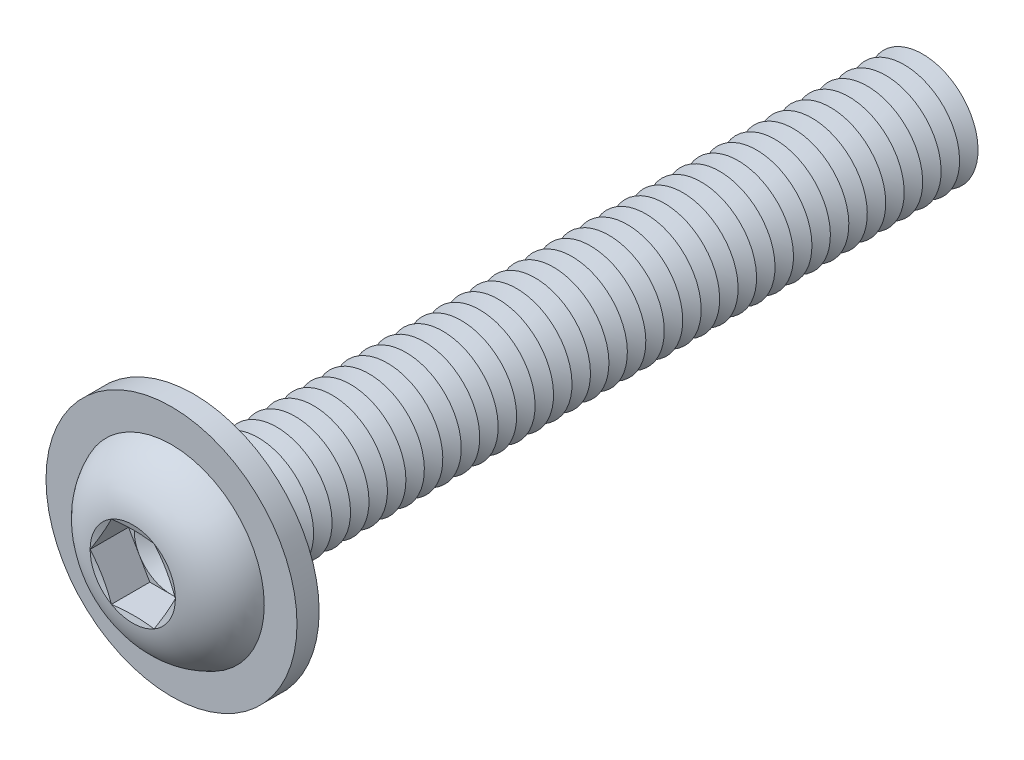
SolidWorks part; units mm, degrees
ref_plane "Front Plane" through (0, 0, 0) normal (0, 0, 1) x (1, 0, 0)
ref_plane "Top Plane" through (0, 0, 0) normal (0, 1, 0) x (1, 0, 0)
ref_plane "Right Plane" through (0, 0, 0) normal (1, 0, 0) x (0, 0, -1)
sketch "Sketch1" plane through (0, 0, 0) normal (1, 0, 0) x (0, 0, -1)
  line L0 (0, 3) -> (0, 5.25)
  line L3 (0, 3) -> (40, 3)
  line L4 (40, 3) -> (40, 0)
  line L5 (40, 0) -> (-3.3, 0) construction
  line L6 (-3.3, 0) -> (40, 0)
  line L7 (-3.3, 2.3094) -> (-3.3, 1.1547) construction
  line L8 (-3.3, 1.1547) -> (-3.3, 0)
  line L9 (-3.3, 2.3094) -> (-2.9906, 1.1547)
  line L10 (-2.9906, 1.1547) -> (-3.3, 1.1547)
  line L11 (40, 0) -> (22.7481, 0) construction
  line L12 (0, 5.25) -> (-3.3, 5.25) construction
  arc A1 (0, 5.25) -> (-3.3, 2.3094) centre (0, 1.928) ccw
  point P8 (40, 1.5)
  dimension "D1" = 10.5
  dimension "D2" = 6
  dimension "D3" = 3.3
  dimension "D4" = 4.6188
  dimension "D5" = 40
  dimension "D6" = 15
revolve "Revolve1" add sketch "Sketch1" angle 360 about L5
fillet "Fillet1" radius 0.5 1 edges at (0, 3, 0)
sketch "Sketch2" plane through (0, 0, 0) normal (1, 0, 0) x (0, 0, -1)
  line L0 (39.5, 3) -> (40.5, 3)
  line L1 (40, 3) -> (0.5, 3) construction
  line L2 (40.5, 3) -> (40, 2.134)
  line L3 (40, -3) -> (40, 3) construction
  line L4 (40, 2.134) -> (39.5, 3)
  dimension "D1" = 1
revolve "Cut-Revolve1" cut sketch "Sketch2" angle 360 about axis through (0, 0, -40) along (0, 0, -1)
pattern_linear "LPattern1" count 40 spacing 1 along (0, 0, 1) of "Cut-Revolve1"
sketch "Sketch3" plane through (0, 0, 3.3) normal (0, 0, 1) x (1, 0, 0)
  line L7 (1.1547, 2) -> (-1.1547, 2)
  line L8 (-1.1547, 2) -> (-2.3094, 0)
  line L9 (-2.3094, 0) -> (-1.1547, -2)
  line L10 (-1.1547, -2) -> (1.1547, -2)
  line L11 (1.1547, -2) -> (2.3094, 0)
  line L12 (2.3094, 0) -> (1.1547, 2)
  circle A0 centre (0, 0) radius 2 construction
  circle A3 centre (0, 0) radius 2.3094 construction
extrude "Cut-Extrude1" cut sketch "Sketch3" against normal blind 2.08
sketch "Sketch4" plane through (0, 0, 1.22) normal (0, 0, 1) x (1, 0, 0)
  line L1 (1.1547, 2) -> (-1.1547, 2) construction
  circle A0 centre (0, 0) radius 2
extrude "Cut-Extrude2" cut sketch "Sketch4" against normal through all draft 60
sketch "Sketch5" plane through (0, 0, 0) normal (0, 0, -1) x (-1, 0, 0)
  circle A0 centre (0, 0) radius 6.8
  circle A1 centre (0, 0) radius 3.5
  circle A2 centre (0, 0) radius 3.5 construction
  dimension "D1" = 13.6
extrude "Boss-Extrude1" add sketch "Sketch5" against normal blind 1.2
